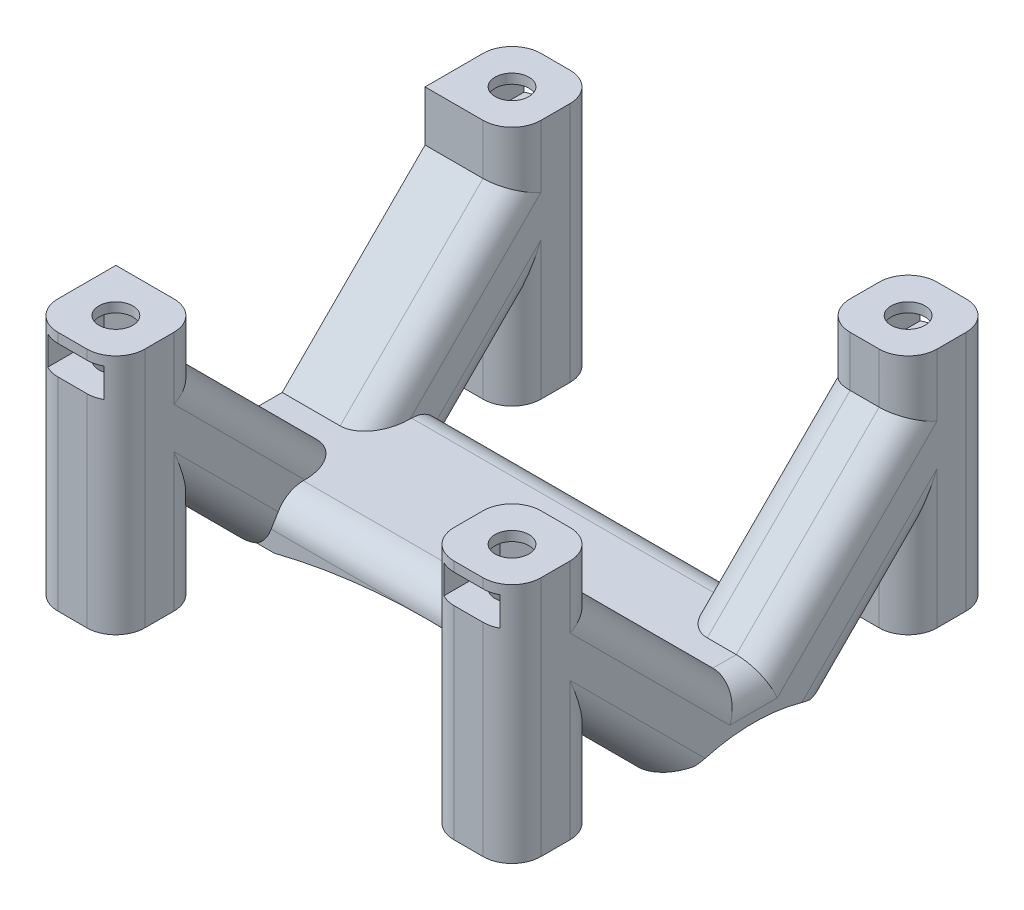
SolidWorks part; units mm, degrees
ref_plane "Front Plane" through (0, 0, 0) normal (0, 0, 1) x (1, 0, 0)
ref_plane "Top Plane" through (0, 0, 0) normal (0, 1, 0) x (1, 0, 0)
ref_plane "Right Plane" through (0, 0, 0) normal (1, 0, 0) x (0, 0, -1)
sketch "Sketch1" plane through (0, 0, 0) normal (0, 1, 0) x (1, 0, 0)
  line L1 (-23, -25) -> (23, -25)
  line L2 (-25, -23) -> (-25, 23)
  line L3 (-23, 25) -> (23, 25)
  line L4 (25, -23) -> (25, 23)
  line L5 (-25, -25) -> (25, 25) construction
  line L6 (-25, 25) -> (25, -25) construction
  line L7 (14, 16) -> (-14, 16)
  line L8 (16, 14) -> (16, -14)
  line L9 (14, -16) -> (-14, -16)
  line L10 (-16, 14) -> (-16, -14)
  line L11 (16, 16) -> (-16, -16) construction
  line L12 (16, -16) -> (-16, 16) construction
  arc A0 (-23, -25) -> (-25, -23) centre (-23, -23) cw
  arc A1 (23, -25) -> (25, -23) centre (23, -23) ccw
  arc A2 (23, 25) -> (25, 23) centre (23, 23) cw
  arc A3 (-25, 23) -> (-23, 25) centre (-23, 23) cw
  circle A4 centre (-20, 20) radius 2.55
  circle A5 centre (20, 20) radius 2.55
  circle A6 centre (20, -20) radius 2.55
  circle A7 centre (-20, -20) radius 2.55
  arc A8 (14, 16) -> (16, 14) centre (14, 14) cw
  arc A9 (16, -14) -> (14, -16) centre (14, -14) cw
  arc A10 (-14, -16) -> (-16, -14) centre (-14, -14) cw
  arc A11 (-14, 16) -> (-16, 14) centre (-14, 14) ccw
  point P0 (0, 0)
  point P26 (0, 0)
  dimension "D3" = 2
  dimension "D8" = 5.1
  dimension "D11" = 2
  dimension "D1" = 50
  dimension "D2" = 50
  dimension "D4" = 5
  dimension "D5" = 5
  dimension "D6" = 5
  dimension "D7" = 5
  dimension "D9" = 32
  dimension "D10" = 32
extrude "Boss-Extrude1" add sketch "Sketch1" along normal blind 5
sketch "Sketch3" plane through (0, 5, 0) normal (0, 1, 0) x (1, 0, 0)
  circle A0 centre (-20, 20) radius 3
  circle A1 centre (20, 20) radius 3
  circle A2 centre (20, -20) radius 3
  circle A3 centre (-20, -20) radius 3
  dimension "D1" = 6
extrude "Boss-Extrude3" add sketch "Sketch3" against normal blind 1.5
sketch "Sketch4" plane through (0, 5, 0) normal (0, 1, 0) x (1, 0, 0)
  line L0 (14, 16) -> (-14, 16) construction
  line L1 (6, -16) -> (-6, -16)
  line L2 (6, -16) -> (6, 16)
  line L3 (6, 16) -> (-6, 16)
  line L4 (-6, -16) -> (-6, 16)
  line L5 (6, -16) -> (-6, 16) construction
  line L6 (6, 16) -> (-6, -16) construction
  point P0 (0, 0)
  dimension "D1" = 12
extrude "Boss-Extrude4" add sketch "Sketch4" against normal up to surface (5 mm away)
sketch "Sketch5" plane through (0, 5, 0) normal (0, 1, 0) x (1, 0, 0)
  line L0 (6, -16) -> (6, 16) construction
  line L1 (-6, -14) -> (6, -14)
  line L2 (-6, -14) -> (-6, 14)
  line L3 (-6, 14) -> (6, 14)
  line L4 (6, -14) -> (6, 14)
  line L5 (-6, -14) -> (6, 14) construction
  line L6 (-6, 14) -> (6, -14) construction
  point P0 (0, 0)
  dimension "D1" = 28
extrude "Boss-Extrude5" add sketch "Sketch5" along normal blind 20
sketch "Sketch6" plane through (6, 0, 0) normal (1, 0, 0) x (0, 0, -1)
  line L0 (0, 0) -> (0, 25.5) construction
  line L1 (0, 22) -> (8.4632, 22) construction
  line L2 (-14, 25) -> (14, 25) construction
  line L3 (-4.2426, 25) -> (0, 20.7574)
  line L4 (0, 20.7574) -> (4.2426, 25)
  line L5 (-4.2426, 25) -> (4.2426, 25)
  circle A1 centre (0, 25) radius 3 construction
  dimension "D1" = 45
  dimension "D3" = 45
  dimension "D2" = 3
extrude "Cut-Extrude1" cut sketch "Sketch6" against normal through all
ref_plane "Plane1" through (0, 24, 0) normal (0, 1, 0) x (1, 0, 0)
sketch "Sketch8" plane through (0, 24, 0) normal (0, 1, 0) x (1, 0, 0)
  line L0 (0, -10) -> (0, 10) construction
  line L1 (0, 6.6514) -> (2.9, 8.3257)
  line L2 (2.9, 8.3257) -> (2.9, 11.6743)
  line L3 (2.9, 11.6743) -> (0, 13.3486)
  line L4 (0, 13.3486) -> (-2.9, 11.6743)
  line L5 (-2.9, 11.6743) -> (-2.9, 8.3257)
  line L6 (-2.9, 8.3257) -> (0, 6.6514)
  line L7 (0, -6.6514) -> (-2.9, -8.3257)
  line L8 (-2.9, -8.3257) -> (-2.9, -11.6743)
  line L9 (-2.9, -11.6743) -> (0, -13.3486)
  line L10 (0, -13.3486) -> (2.9, -11.6743)
  line L11 (2.9, -11.6743) -> (2.9, -8.3257)
  line L12 (2.9, -8.3257) -> (0, -6.6514)
  circle A0 centre (0, 10) radius 2.9 construction
  circle A1 centre (0, -10) radius 2.9 construction
  point P3 (0, 0)
  dimension "D1" = 20
  dimension "D2" = 5.8
extrude "Cut-Extrude2" cut sketch "Sketch8" against normal blind 3
sketch "Sketch9" plane through (0, 25, 0) normal (0, 1, 0) x (1, 0, 0)
  line L0 (0, -10) -> (0, 10) construction
  circle A0 centre (0, 10) radius 1.75
  circle A1 centre (0, -10) radius 1.75
  point P4 (0, 0)
  dimension "D2" = 3.5
  dimension "D1" = 20
extrude "Cut-Extrude3" cut sketch "Sketch9" against normal through all
sketch "Sketch10" plane through (0, 25, 0) normal (0, 1, 0) x (1, 0, 0)
  line L1 (-6, -4.2426) -> (-2.5, -4.2426)
  line L2 (-6, -4.2426) -> (-6, 4.2426)
  line L3 (-6, 4.2426) -> (-2.5, 4.2426)
  line L4 (-2.5, -4.2426) -> (-2.5, 4.2426)
  line L6 (6, 4.2426) -> (2.5, 4.2426)
  line L7 (6, 4.2426) -> (6, -4.2426)
  line L8 (6, -4.2426) -> (2.5, -4.2426)
  line L9 (2.5, 4.2426) -> (2.5, -4.2426)
  line L10 (-2.5, 4.2426) -> (-6, 7.7426)
  line L11 (-6, 14) -> (-6, 4.2426) construction
  line L12 (-6, 7.7426) -> (-6, 4.2426)
  line L13 (2.5, 4.2426) -> (6, 7.7426)
  line L14 (6, 4.2426) -> (6, 14) construction
  line L15 (6, 7.7426) -> (6, 4.2426)
  line L16 (6, -4.2426) -> (6, -7.7426)
  line L17 (6, -14) -> (6, -4.2426) construction
  line L18 (6, -7.7426) -> (2.5, -4.2426)
  line L19 (-6, -4.2426) -> (-6, -7.7426)
  line L20 (-6, -4.2426) -> (-6, -14) construction
  line L21 (-6, -7.7426) -> (-2.5, -4.2426)
  line L22 (6, -4.2426) -> (-6, -4.2426) construction
  line L23 (-6, 4.2426) -> (6, 4.2426) construction
  dimension "D1" = 2.5
  dimension "D2" = 2.5
  dimension "D3" = 45
  dimension "D4" = 45
  dimension "D5" = 45
  dimension "D6" = 45
extrude "Cut-Extrude4" cut sketch "Sketch10" against normal up to surface (20 mm away)
sketch "Sketch11" plane through (0, 0, 14) normal (0, 0, 1) x (1, 0, 0)
  line L1 (-2.9, 24) -> (2.9, 24)
  line L2 (-2.9, 24) -> (-2.9, 21)
  line L3 (-2.9, 21) -> (2.9, 21)
  line L4 (2.9, 24) -> (2.9, 21)
extrude "Cut-Extrude5" cut sketch "Sketch11" against normal up to vertex
sketch "Sketch12" plane through (0, 0, -14) normal (0, 0, -1) x (-1, 0, 0)
  line L1 (-2.9, 24) -> (2.9, 24)
  line L2 (-2.9, 24) -> (-2.9, 21)
  line L3 (-2.9, 21) -> (2.9, 21)
  line L4 (2.9, 24) -> (2.9, 21)
extrude "Cut-Extrude6" cut sketch "Sketch12" against normal up to vertex
sketch "Sketch13" plane through (0, 5, 0) normal (0, 1, 0) x (1, 0, 0)
  line L0 (23, 25) -> (175, 25)
  line L1 (23, -25) -> (175, -25)
  line L2 (175, -25) -> (175, 25)
  line L4 (25, -23) -> (25, 23) construction
  dimension "D1" = 150
pattern_linear "LPattern1" count 4 spacing 50 along (1, 0, 0) of "Boss-Extrude1"
pattern_linear "LPattern2" count 4 spacing 50 along (1, 0, 0) of "Boss-Extrude3"
sketch "Sketch14" plane through (0, 5, 0) normal (0, 1, 0) x (1, 0, 0)
  line L1 (125, 25) -> (134, 25)
  line L2 (125, 25) -> (125, -25)
  line L3 (125, -25) -> (134, -25)
  line L4 (134, 25) -> (134, -25)
  line L7 (134, 14) -> (134, -14) construction
  line L8 (173, 25) -> (127, 25) construction
  line L9 (23, -25) -> (175, -25) construction
  arc A0 (125, -23) -> (127, -25) centre (127, -23) ccw construction
extrude "Boss-Extrude6" add sketch "Sketch14" along normal up to vertex
sketch "Sketch15" plane through (134, 0, 0) normal (1, 0, 0) x (0, 0, -1)
  line L0 (-4.2426, 25) -> (4.2426, 25) construction
  line L1 (-16, 19.7868) -> (0, 3.7868)
  line L3 (0, 0) -> (0, 25.5) construction
  line L4 (0, 3.7868) -> (16, 19.7868)
  line L5 (-16, 25) -> (16, 25)
  line L6 (16, 25) -> (16, 19.7868)
  line L7 (-16, 25) -> (-16, 19.7868)
  line L8 (-25, 25) -> (-25, 5) construction
  line L9 (25, 25) -> (25, 5) construction
  line L10 (-25, 25) -> (25, 25) construction
  circle A0 centre (0, 25) radius 15 construction
  dimension "D1" = 30
  dimension "D2" = 45
  dimension "D3" = 9
  dimension "D4" = 9
extrude "Cut-Extrude7" cut sketch "Sketch15" against normal up to surface (9 mm away)
sketch "Sketch16" plane through (0, 0, 0) normal (0, -1, 0) x (1, 0, 0)
  line L0 (173, 25) -> (175, 25)
  line L1 (175, 25) -> (175, 23)
  line L2 (123, 25) -> (127, 25)
  line L3 (123, -25) -> (127, -25)
  line L4 (175, -23) -> (175, -25)
  line L5 (175, -25) -> (173, -25)
  arc A0 (175, 23) -> (173, 25) centre (173, 23) ccw construction
  arc A1 (173, -25) -> (175, -23) centre (173, -23) ccw construction
  arc A2 (125, -23) -> (127, -25) centre (127, -23) ccw construction
  arc A3 (123, -25) -> (125, -23) centre (123, -23) ccw construction
  arc A4 (127, 25) -> (125, 23) centre (127, 23) ccw construction
  arc A5 (125, 23) -> (123, 25) centre (123, 23) ccw construction
  arc A6 (175, 23) -> (173, 25) centre (173, 23) ccw
  arc A7 (173, -25) -> (175, -23) centre (173, -23) ccw
  arc A8 (125, -23) -> (127, -25) centre (127, -23) ccw
  arc A9 (123, -25) -> (125, -23) centre (123, -23) ccw
  arc A10 (127, 25) -> (125, 23) centre (127, 23) ccw
  arc A11 (125, 23) -> (123, 25) centre (123, 23) ccw
extrude "Boss-Extrude7" add sketch "Sketch16" against normal up to surface (5 mm away)
pattern_linear "LPattern3" count 2 spacing 41 along (1, 0, 0) of "Boss-Extrude6", "Cut-Extrude7"
sketch "Sketch17" plane through (0, 5, 0) normal (0, 1, 0) x (1, 0, 0)
  line L0 (-6, -7.7426) -> (-6, -14) construction
  line L1 (-25, 25) -> (-6, 25)
  line L2 (-25, 25) -> (-25, -25)
  line L3 (-25, -25) -> (-6, -25)
  line L4 (-6, 25) -> (-6, -25)
  line L5 (23, 25) -> (-23, 25) construction
  line L6 (-23, -25) -> (23, -25) construction
  line L7 (-25, 23) -> (-25, -23) construction
extrude "Cut-Extrude8" cut sketch "Sketch17" against normal through all
sketch "Sketch19" plane through (0, 0, 0) normal (0, -1, 0) x (1, 0, 0)
  line L0 (164, -16) -> (136, -16) construction
  line L1 (116, 16) -> (175, 16)
  line L2 (116, 16) -> (116, -16)
  line L3 (116, -16) -> (175, -16)
  line L4 (175, 16) -> (175, -16)
  line L5 (116, 14) -> (116, -14) construction
  line L6 (136, 16) -> (164, 16) construction
  line L8 (175, 25) -> (175, -25) construction
extrude "Boss-Extrude8" add sketch "Sketch19" against normal up to surface (5 mm away)
sketch "Sketch21" plane through (0, 24, 0) normal (0, 1, 0) x (1, 0, 0)
  line L0 (129.5, -25) -> (129.5, -16) construction
  line L1 (125, -25) -> (134, -25) construction
  line L2 (125, -16) -> (134, -16) construction
  line L3 (170.5, -25) -> (170.5, -16) construction
  line L4 (129.5, -23.8486) -> (132.4, -22.1743)
  line L5 (132.4, -22.1743) -> (132.4, -18.8257)
  line L6 (132.4, -18.8257) -> (129.5, -17.1514)
  line L7 (129.5, -17.1514) -> (126.6, -18.8257)
  line L8 (126.6, -18.8257) -> (126.6, -22.1743)
  line L9 (126.6, -22.1743) -> (129.5, -23.8486)
  line L10 (166, -25) -> (175, -25) construction
  line L11 (166, -16) -> (175, -16) construction
  line L12 (170.5, 16) -> (170.5, 25) construction
  line L13 (170.5, -23.8486) -> (173.4, -22.1743)
  line L14 (173.4, -22.1743) -> (173.4, -18.8257)
  line L15 (173.4, -18.8257) -> (170.5, -17.1514)
  line L16 (170.5, -17.1514) -> (167.6, -18.8257)
  line L17 (167.6, -18.8257) -> (167.6, -22.1743)
  line L18 (167.6, -22.1743) -> (170.5, -23.8486)
  line L19 (166, 16) -> (175, 16) construction
  line L20 (175, 25) -> (166, 25) construction
  line L21 (129.5, 25) -> (129.5, 16) construction
  line L22 (170.5, 17.1514) -> (173.4, 18.8257)
  line L23 (173.4, 18.8257) -> (173.4, 22.1743)
  line L24 (173.4, 22.1743) -> (170.5, 23.8486)
  line L25 (170.5, 23.8486) -> (167.6, 22.1743)
  line L26 (167.6, 22.1743) -> (167.6, 18.8257)
  line L27 (167.6, 18.8257) -> (170.5, 17.1514)
  line L28 (134, 25) -> (125, 25) construction
  line L29 (125, 16) -> (134, 16) construction
  line L31 (129.5, 17.1514) -> (132.4, 18.8257)
  line L32 (132.4, 18.8257) -> (132.4, 22.1743)
  line L33 (132.4, 22.1743) -> (129.5, 23.8486)
  line L34 (129.5, 23.8486) -> (126.6, 22.1743)
  line L35 (126.6, 22.1743) -> (126.6, 18.8257)
  line L36 (126.6, 18.8257) -> (129.5, 17.1514)
  circle A0 centre (129.5, -20.5) radius 2.9 construction
  circle A1 centre (170.5, -20.5) radius 2.9 construction
  circle A2 centre (170.5, 20.5) radius 2.9 construction
  circle A3 centre (129.5, 20.5) radius 2.9 construction
  dimension "D1" = 5.8
  dimension "D2" = 5.8
  dimension "D3" = 5.8
  dimension "D4" = 5.8
extrude "Cut-Extrude9" cut sketch "Sketch21" against normal blind 3
sketch "Sketch23" plane through (0, 25, 0) normal (0, 1, 0) x (1, 0, 0)
  line L0 (125, 0) -> (175, 0) construction
  line L1 (175, -1.2132) -> (175, 1.2132) construction
  line L2 (125, 16) -> (125, 1.2132) construction
  line L4 (170.5, -20.5) -> (129.5, -20.5) construction
  line L5 (170.5, -20.5) -> (170.5, 20.5) construction
  line L6 (170.5, 20.5) -> (129.5, 20.5) construction
  line L7 (129.5, -20.5) -> (129.5, 20.5) construction
  line L8 (170.5, -20.5) -> (129.5, 20.5) construction
  line L9 (170.5, 20.5) -> (129.5, -20.5) construction
  line L10 (129.5, 16) -> (129.5, 25) construction
  line L11 (125, 16) -> (134, 16) construction
  line L12 (134, 25) -> (125, 25) construction
  circle A0 centre (129.5, -20.5) radius 1.75
  circle A1 centre (170.5, -20.5) radius 1.75
  circle A2 centre (170.5, 20.5) radius 1.75
  circle A3 centre (129.5, 20.5) radius 1.75
  point P4 (150, 0)
  dimension "D1" = 3.5
extrude "Cut-Extrude10" cut sketch "Sketch23" against normal through all
sketch "Sketch24" plane through (0, 0, 25) normal (0, 0, 1) x (1, 0, 0)
  line L1 (126.6, 24) -> (132.4, 24)
  line L2 (126.6, 24) -> (126.6, 21)
  line L3 (126.6, 21) -> (132.4, 21)
  line L4 (132.4, 24) -> (132.4, 21)
  line L5 (167.6, 24) -> (173.4, 24)
  line L6 (167.6, 24) -> (167.6, 21)
  line L7 (167.6, 21) -> (173.4, 21)
  line L8 (173.4, 24) -> (173.4, 21)
extrude "Cut-Extrude11" cut sketch "Sketch24" against normal up to vertex
sketch "Sketch25" plane through (0, 0, -25) normal (0, 0, -1) x (-1, 0, 0)
  line L1 (-173.4, 24) -> (-167.6, 24)
  line L2 (-173.4, 24) -> (-173.4, 21)
  line L3 (-173.4, 21) -> (-167.6, 21)
  line L4 (-167.6, 24) -> (-167.6, 21)
  line L5 (-132.4, 24) -> (-126.6, 24)
  line L6 (-132.4, 24) -> (-132.4, 21)
  line L7 (-132.4, 21) -> (-126.6, 21)
  line L8 (-126.6, 24) -> (-126.6, 21)
extrude "Cut-Extrude12" cut sketch "Sketch25" against normal up to vertex
ref_plane "Plane2" through (-0.44, 0, 0) normal (1, 0, 0) x (0, 0, -1)
sketch "Sketch26" plane through (-0.44, 0, 0) normal (1, 0, 0) x (0, 0, -1)
  line L0 (-4.2426, 25) -> (4.2426, 25) construction
  line L1 (-4.2426, 25) -> (-2.75, 25)
  line L2 (-4.2426, 25) -> (0, 20.7574)
  line L3 (0, 20.7574) -> (4.2426, 25)
  line L4 (4.2426, 25) -> (2.75, 25)
  arc A1 (-2.75, 25) -> (2.75, 25) centre (0, 25) ccw
  dimension "D2" = 5.5
extrude "Boss-Extrude9" add sketch "Sketch26" against normal up to surface (2.06 mm away)
sketch "Sketch27" plane through (0, 5, 0) normal (0, 1, 0) x (1, 0, 0)
  line L0 (166, 16) -> (166, 1.2132) construction
  line L1 (134, 25) -> (166, 25)
  line L2 (134, 25) -> (134, 8.6066)
  line L3 (134, 8.6066) -> (166, 8.6066)
  line L4 (166, 25) -> (166, 8.6066)
  line L5 (134, -16) -> (134, -1.2132) construction
  line L6 (166, -25) -> (134, -25)
  line L7 (166, -25) -> (166, -8.6066)
  line L8 (166, -8.6066) -> (134, -8.6066)
  line L9 (134, -25) -> (134, -8.6066)
extrude "Cut-Extrude13" cut sketch "Sketch27" against normal through all
sketch "Sketch28" plane through (0, 0, 8.6066) normal (0, 0, 1) x (1, 0, 0)
  line L0 (166, 5) -> (134, 5) construction
  line L2 (134, 0) -> (166, 0)
  arc A0 (134, 0) -> (166, 0) centre (150, -63) cw
  point P9 (150, 2)
  dimension "D1" = 3
extrude "Cut-Extrude14" cut sketch "Sketch28" against normal through all
sketch "Sketch29" plane through (0, 25, 0) normal (0, 1, 0) x (1, 0, 0)
  line L0 (-6, -25) -> (23, -25) construction
  line L1 (-6, 25) -> (-4.75, 25)
  line L2 (-6, 25) -> (-6, -25)
  line L3 (-6, -25) -> (-4.75, -25)
  line L4 (-4.75, 25) -> (-4.75, -25)
  line L5 (23, 25) -> (-6, 25) construction
  line L6 (6, 25) -> (4.75, 25)
  line L7 (6, 25) -> (6, -25)
  line L8 (6, -25) -> (4.75, -25)
  line L9 (4.75, 25) -> (4.75, -25)
  line L10 (6, -14) -> (6, -7.7426) construction
  dimension "D1" = 9.5
extrude "Cut-Extrude15" cut sketch "Sketch29" against normal up to surface (20 mm away)
sketch "Sketch30" plane through (0, 0, -25) normal (0, 0, -1) x (-1, 0, 0)
  line L0 (-125, 5) -> (-77, 5) construction
  line L1 (-73, 5) -> (-27, 5) construction
  line L2 (-34, 0) -> (-66, 0)
  line L3 (-116, 0) -> (-84, 0)
  arc A0 (-116, 0) -> (-84, 0) centre (-100, -63) cw
  arc A1 (-66, 0) -> (-34, 0) centre (-50, -63) cw
  point P3 (-100, 2)
  point P11 (-50, 2)
  dimension "D1" = 3
  dimension "D2" = 3
extrude "Cut-Extrude16" cut sketch "Sketch30" against normal through all
sketch "Sketch32" plane through (0, 5, 0) normal (0, 1, 0) x (1, 0, 0)
  line L0 (-4.75, 6.4926) -> (-4.75, 14) construction
  line L1 (-2.5, 4.2426) -> (-4.75, 6.4926) construction
  line L2 (-2.5, -4.2426) -> (-2.5, 4.2426) construction
  line L3 (-2.5, -4.2426) -> (-2.5, -2.75) construction
  line L4 (-4.75, -6.4926) -> (-2.5, -4.2426) construction
  line L5 (-4.75, -14) -> (-4.75, -6.4926) construction
  line L13 (-4.75, 6.4926) -> (-4.75, 14)
  line L14 (-2.5, 4.2426) -> (-4.75, 6.4926)
  line L15 (-2.5, -4.2426) -> (-2.5, 4.2426)
  line L16 (-2.5, -4.2426) -> (-2.5, -2.75)
  line L17 (-4.75, -6.4926) -> (-2.5, -4.2426)
  line L18 (-4.75, -14) -> (-4.75, -6.4926)
  line L26 (-6, 25) -> (-6, -25)
  line L27 (-4.75, -25) -> (-4.75, -14)
  line L28 (-6, -25) -> (23, -25) construction
  line L29 (-6, 25) -> (-4.75, 25)
  line L30 (23, 25) -> (-6, 25) construction
  line L31 (-4.75, 25) -> (-4.75, 14)
  line L32 (-2.5, -4.2426) -> (-4.75, -6.4926)
  line L33 (-2.5, -4.2426) -> (-2.5, 4.2426)
  line L34 (-2.5, -4.2426) -> (-4.75, -6.4926)
  line L35 (-4.75, -25) -> (-6, -25)
extrude "Cut-Extrude17" cut sketch "Sketch32" against normal through all contours L35 L27 L18 L17 L15 L14 L13 L31 L29 L26
fillet "Fillet1" radius 11 2 edges at (-4.75, 2.5, -25) (-4.75, 2.5, 25)
fillet "Fillet2" radius 5 12 edges at (84.5858, 5, -15.4142) (115.4142, 5, -15.4142) (116, 5, 0) (115.4142, 5, 15.4142) (84.5858, 5, 15.4142) (84, 5, 0) (65.4142, 5, -15.4142) (66, 5, 0) (65.4142, 5, 15.4142) (34.5858, 5, 15.4142) (34, 5, 0) (34.5858, 5, -15.4142)
fillet "Fillet10" radius 3 2 edges at (150, 5, 8.6066) (150, 5, -8.6066)
fillet "Fillet11" radius 3 29 edges at (125, 15, -25) (125, 15, 25) (134, 12.5, 25) (134, 12.5, -25) (134, 22.3934, -16) (134, 22.3934, 16) (134, 12.3934, 8.6066) (175, 12.5, -25) (175, 12.5, 25) (166, 12.5, -25) (166, 12.5, 25) (175, 22.3934, -16) (175, 22.3934, 16) (175, 12.3934, 8.6066) (166, 12.3934, -8.6066) (166, 22.3934, 16) (166, 22.3934, -16) (166, 12.3934, 8.6066) (175, 12.3934, -8.6066) (134, 12.3934, -8.6066) (175, 5, 0) (126.6, 22.5, 25) (132.4, 22.5, 25) (167.6, 22.5, 25) (173.4, 22.5, 25) (173.4, 22.5, -25) (167.6, 22.5, -25) (132.4, 22.5, -25) (126.6, 22.5, -25)
sketch "Sketch33" plane through (0, 5, 0) normal (0, 1, 0) x (1, 0, 0)
  line L0 (125, 22) -> (125, -22)
  line L1 (128, -25) -> (-10.0486, -25)
  line L2 (-10.0486, -25) -> (-10.0486, 25)
  line L3 (-10.0486, 25) -> (128, 25)
  arc A0 (125, 22) -> (128, 25) centre (128, 22) cw
  arc A1 (125, -22) -> (128, -25) centre (128, -22) ccw
  dimension "D1" = 3
  dimension "D3" = 3
  dimension "D2" = 44
extrude "Cut-Extrude18" cut sketch "Sketch33" against normal through all both and the other way through all
sketch "Sketch34" plane through (125, 0, 0) normal (-1, 0, 0) x (0, 0, 1)
  line L0 (-6, 0) -> (-6, 12.3934) construction
  line L1 (-22, 0) -> (22, 0) construction
  line L2 (6, 0) -> (6, 12.9522) construction
  line L7 (-6, 0) -> (6, 0)
  line L8 (-16, 25) -> (-16, 19.7868) construction
  line L9 (16, 19.7868) -> (16, 25) construction
  line L10 (-1.2132, 5) -> (1.2132, 5) construction
  arc A0 (-6, 0) -> (6, 0) centre (0, -17.5) cw
  point P14 (0, 1)
  dimension "D1" = 10
  dimension "D2" = 10
  dimension "D3" = 4
extrude "Cut-Extrude19" cut sketch "Sketch34" against normal through all both and the other way through all
sketch "Sketch35" plane through (125, 0, 0) normal (-1, 0, 0) x (0, 0, 1)
  line L0 (-16, 7.0589) -> (-16, 0)
  line L1 (-16, 0) -> (-8.9411, 0)
  line L2 (-8.9411, 0) -> (-16, 7.0589)
  line L4 (-22, 25) -> (-22, 0) construction
  line L5 (-22, 0) -> (-6, 0) construction
  line L6 (0, 0) -> (0, 5) construction
  line L8 (16, 7.0589) -> (16, 0)
  line L9 (8.9411, 0) -> (16, 7.0589)
  line L10 (16, 0) -> (8.9411, 0)
  line L12 (-16, 19.7868) -> (-1.2132, 5) construction
  dimension "D1" = 6
  dimension "D2" = 9
extrude "Cut-Extrude20" cut sketch "Sketch35" against normal through all both and the other way through all
fillet "Fillet13" radius 3 20 edges at (134, 1, -8.6066) (166, 1, -8.6066) (166, 1, 8.6066) (134, 1, 8.6066) (125, 3.5294, 16) (125, 3.5294, 12.4706) (125, 3.5294, -16) (125, 3.5294, -12.4706) (134, 3.5294, -12.4706) (166, 3.5294, -12.4706) (175, 3.5294, -12.4706) (134, 3.5294, -16) (166, 3.5294, -16) (175, 3.5294, -16) (134, 3.5294, 12.4706) (166, 3.5294, 12.4706) (175, 3.5294, 12.4706) (134, 3.5294, 16) (166, 3.5294, 16) (175, 3.5294, 16)
sketch "Sketch36" plane through (125, 0, 0) normal (-1, 0, 0) x (0, 0, 1)
  line L0 (-8.9411, 0) -> (-6, 0) construction
  line L1 (6, 0) -> (8.9411, 0) construction
  line L2 (8.6066, 0) -> (8.6066, 2) construction
  line L3 (5.4558, 5) -> (1.2132, 5) construction
  line L4 (-1.2132, 5) -> (1.2132, 5) construction
  line L5 (-1.2132, 5) -> (-5.4558, 5) construction
  line L6 (-8.6066, 2) -> (-8.6066, 0) construction
  line L7 (-8.6066, 0) -> (-6, 0)
  line L8 (6, 0) -> (8.6066, 0)
  line L9 (8.6066, 0) -> (8.6066, 2)
  line L10 (5.4558, 5) -> (1.2132, 5)
  line L11 (-1.2132, 5) -> (1.2132, 5)
  line L12 (-1.2132, 5) -> (-5.4558, 5)
  line L13 (-8.6066, 2) -> (-8.6066, 0)
  line L14 (-5.6066, 5) -> (-5.4558, 5)
  line L15 (5.4558, 5) -> (5.6066, 5)
  arc A0 (-5.0078, 0.3093) -> (-6, 0) centre (0, -17.5) ccw construction
  arc A1 (6, 0) -> (5.0078, 0.3093) centre (0, -17.5) ccw construction
  arc A2 (5.0078, 0.3093) -> (-5.0078, 0.3093) centre (0, -17.5) ccw construction
  arc A3 (8.6066, 2) -> (8.2024, 3.5039) centre (5.6066, 2) ccw construction
  arc A4 (8.2024, 3.5039) -> (5.6066, 5) centre (5.6066, 2) ccw construction
  arc A5 (-5.6066, 5) -> (-8.2024, 3.5039) centre (-5.6066, 2) ccw construction
  arc A6 (-8.2024, 3.5039) -> (-8.6066, 2) centre (-5.6066, 2) ccw construction
  arc A7 (-5.0078, 0.3093) -> (-6, 0) centre (0, -17.5) ccw
  arc A8 (6, 0) -> (5.0078, 0.3093) centre (0, -17.5) ccw
  arc A9 (5.0078, 0.3093) -> (-5.0078, 0.3093) centre (0, -17.5) ccw
  arc A10 (8.6066, 2) -> (8.2024, 3.5039) centre (5.6066, 2) ccw
  arc A11 (8.2024, 3.5039) -> (5.6066, 5) centre (5.6066, 2) ccw
  arc A12 (-5.6066, 5) -> (-8.2024, 3.5039) centre (-5.6066, 2) ccw
  arc A13 (-8.2024, 3.5039) -> (-8.6066, 2) centre (-5.6066, 2) ccw
extrude "Boss-Extrude10" [suppressed] add sketch "Sketch36" along normal blind 122 and the other way up to surface contours L14 A12 A11 L15 L10 L12 M16 M1 M2 M9 | A13 L13 L7 A7 M16 | L9 A10 A8 L8 M2
sketch "Sketch37" [suppressed] plane through (3, 0, 0) normal (-1, 0, 0) x (0, 0, 1)
  line L0 (-16, 25) -> (-4.2426, 25) construction
  line L1 (-12.2426, 0) -> (12.2426, 0)
  line L2 (-12.2426, 0) -> (-12.2426, 25)
  line L3 (-12.2426, 25) -> (-4.2426, 25)
  line L4 (12.2426, 0) -> (12.2426, 25)
  line L5 (16, 25) -> (22, 25) construction
  line L6 (-4.2426, 25) -> (0, 20.7574)
  line L7 (0, 20.7574) -> (4.2426, 25)
  line L8 (4.2426, 25) -> (16, 25) construction
  line L9 (4.2426, 25) -> (12.2426, 25)
  line L10 (-4.2426, 25) -> (4.2426, 25) construction
  circle A0 centre (0, 25) radius 3 construction
  point P4 (0, 0)
  dimension "D1" = 45
  dimension "D5" = 6
  dimension "D2" = 45
  dimension "D3" = 8
  dimension "D4" = 8
extrude "Boss-Extrude11" [suppressed] add sketch "Sketch37" along normal blind 8
sketch "Sketch38" [suppressed] plane through (-5, 0, 0) normal (-1, 0, 0) x (0, 0, 1)
  line L0 (-5.6066, 5) -> (5.6066, 5) construction
  line L1 (-4.2426, 5) -> (4.2426, 5)
  line L2 (-4.2426, 5) -> (-4.2426, 19)
  line L4 (4.2426, 5) -> (4.2426, 19)
  line L5 (-12.2426, 25) -> (-12.2426, 0) construction
  line L6 (12.2426, 0) -> (12.2426, 25) construction
  line L7 (-4.2426, 19) -> (0, 14.7574)
  line L8 (0, 14.7574) -> (4.2426, 19)
  line L9 (4.2426, 25) -> (0, 20.7574) construction
  dimension "D1" = 8
  dimension "D2" = 8
  dimension "D3" = 45
  dimension "D4" = 45
  dimension "D5" = 4.2426
  dimension "D6" = 6
extrude "Cut-Extrude21" [suppressed] cut sketch "Sketch38" against normal up to surface and the other way through all
